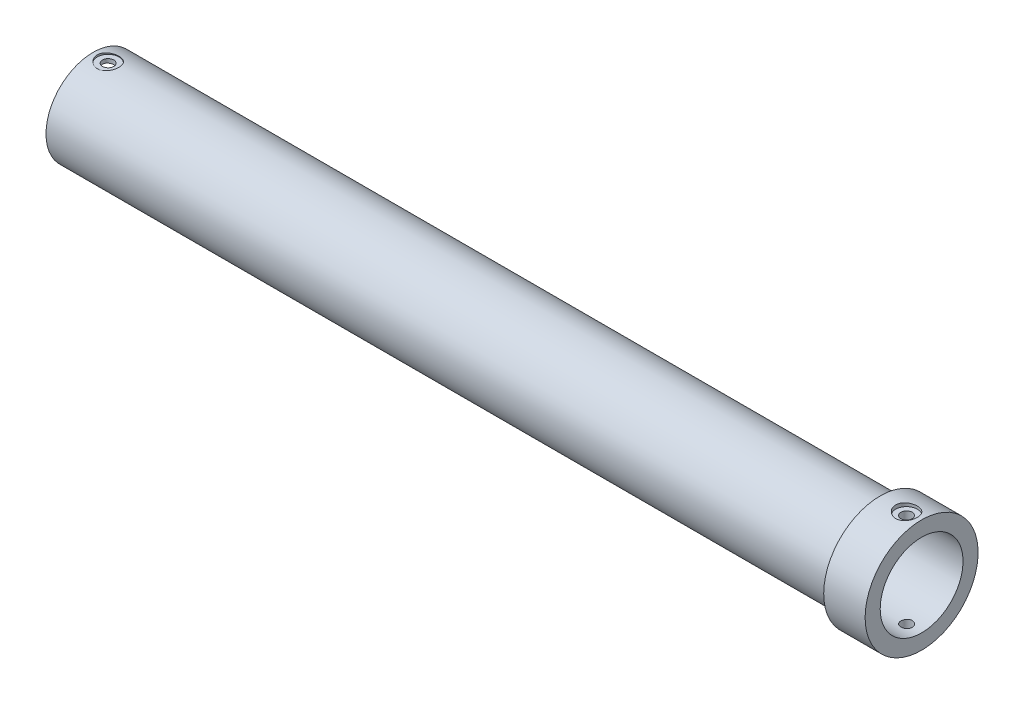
SolidWorks part; units mm, degrees
ref_plane "Plane1" through (0, 0, 0) normal (0, 0, 1) x (1, 0, 0)
ref_plane "Plane2" through (0, 0, 0) normal (0, 1, 0) x (1, 0, 0)
ref_plane "Plane3" through (0, 0, 0) normal (1, 0, 0) x (0, 0, -1)
sketch "Sketch1" plane through (0, 0, 0) normal (0, 0, 1) x (1, 0, 0)
  line L0 (0, 0) -> (108, 0) construction
  line L1 (0, 11) -> (153, 11)
  line L2 (153, 5) -> (155, 5)
  line L3 (153, 5) -> (153, 11)
  line L4 (220, 11) -> (220, 15)
  line L5 (220, 15) -> (209, 15)
  line L6 (0, 12.5) -> (0, 11)
  line L7 (155, 5) -> (155, 11)
  line L8 (155, 11) -> (220, 11)
  line L9 (209, 13) -> (208.134, 12.5)
  line L10 (208.134, 12.5) -> (0, 12.5)
  line L12 (209, 15) -> (209, 13)
  dimension "D1" = 11
  dimension "D2" = 30
  dimension "D3" = 65
  dimension "D4" = 2
  dimension "D5" = 220
  dimension "D6" = 5
  dimension "D7" = 12.5
  dimension "D8" = 30
  dimension "D9" = 11
  dimension "D10" = 0.5
revolve "Base-Revolve" add sketch "Sketch1" angle 360 about L0
ref_plane "Plane4" through (0, 15, 0) normal (0, 1, 0) x (-1, 0, 0)
sketch "Sketch2" plane through (0, 15, 0) normal (0, 1, 0) x (-1, 0, 0)
  line L0 (-220, 15) -> (-220, -15) construction
  circle A0 centre (-216, 0) radius 1.5
  dimension "D2" = 3
  dimension "D1" = 4
extrude "Cut-Extrude1" cut sketch "Sketch2" against normal blind 12
sketch "Sketch4" plane through (0, 15, 0) normal (0, 1, 0) x (-1, 0, 0)
  circle A0 centre (-216, 0) radius 2.875
  dimension "D1" = 5.75
extrude "Cut-Extrude3" cut sketch "Sketch4" against normal blind 1
pattern_circular "CirPattern1" count 2 over 360 about axis through (0, 0, 0) along (1, 0, 0) of "Cut-Extrude3", "Cut-Extrude1"
sketch "Sketch7" plane through (0, 15, 0) normal (0, 1, 0) x (-1, 0, 0)
  line L1 (0, 0) -> (-108, 0) construction
  circle A0 centre (-4, 0) radius 1.5
  dimension "D2" = 3
  dimension "D1" = 4
extrude "Cut-Extrude6" cut sketch "Sketch7" against normal blind 10
pattern_circular "CirPattern3" count 2 over 360 about axis through (4, 0, 0) along (0, 1, 0) of "Cut-Extrude6"
ref_plane "Plane5" through (0, 12.5, 0) normal (0, 1, 0) x (-1, 0, 0)
sketch "Sketch8" plane through (0, 12.5, 0) normal (0, 1, 0) x (-1, 0, 0)
  circle A0 centre (-4, 0) radius 2.875
  dimension "D1" = 5.75
extrude "Cut-Extrude7" cut sketch "Sketch8" against normal blind 0.5
pattern_circular "CirPattern4" count 2 over 360 about axis through (0, 0, 0) along (1, 0, 0) of "Cut-Extrude7"
sketch "Sketch9" plane through (155, 0, 0) normal (1, 0, 0) x (0, 0, -1)
  circle A0 centre (0, 7) radius 1.25
  dimension "D2" = 2.5
  dimension "D1" = 7
extrude "Cut-Extrude8" cut sketch "Sketch9" against normal blind 10
pattern_circular "CirPattern5" count 3 over 360 about axis through (0, 0, 0) along (1, 0, 0) of "Cut-Extrude8"
